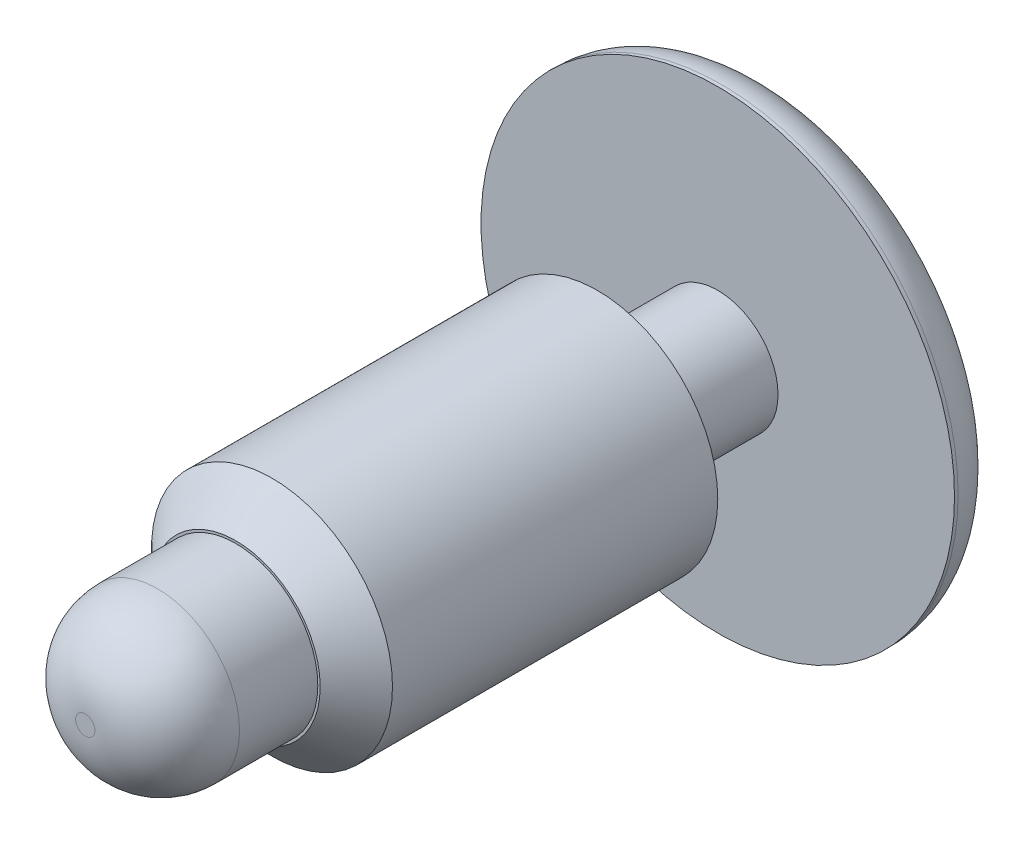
SolidWorks part; units mm, degrees
ref_plane "Front"
ref_plane "Top" through (0, 0, 0) normal (0, 1, 0) x (1, 0, 0)
ref_plane "Right" through (0, 0, 0) normal (1, 0, 0) x (0, 0, -1)
sketch "Sketch1" plane through (0, 0, 0) normal (0, 0, 1) x (1, 0, 0)
  circle A0 centre (0, 0) radius 4.9911
  dimension "D1" = 9.9822
extrude "Extrude1" add sketch "Sketch1" along normal blind 1.0922
sketch "Sketch2" plane through (0, 0, 1.0922) normal (0, 0, 1) x (1, 0, 0)
  circle A0 centre (0, 0) radius 1.27
  dimension "D1" = 2.54
extrude "Extrude2" add sketch "Sketch2" along normal blind 10.16
sketch "Sketch3" plane through (0, 0, 11.2522) normal (0, 0, 1) x (1, 0, 0)
  circle A0 centre (0, 0) radius 2.54
  dimension "D1" = 5.08
extrude "Extrude3" add sketch "Sketch3" against normal blind 7.62
sketch "Sketch4" plane through (0, 0, 11.2522) normal (0, 0, 1) x (1, 0, 0)
  circle A0 centre (0, 0) radius 1.7272
  dimension "D1" = 3.4544
extrude "Extrude4" add sketch "Sketch4" along normal blind 3.175
fillet "Fillet1" radius 1.524
chamfer "Chamfer4" distance 0.762 angle 45
fillet "Fillet2" radius 1.016
